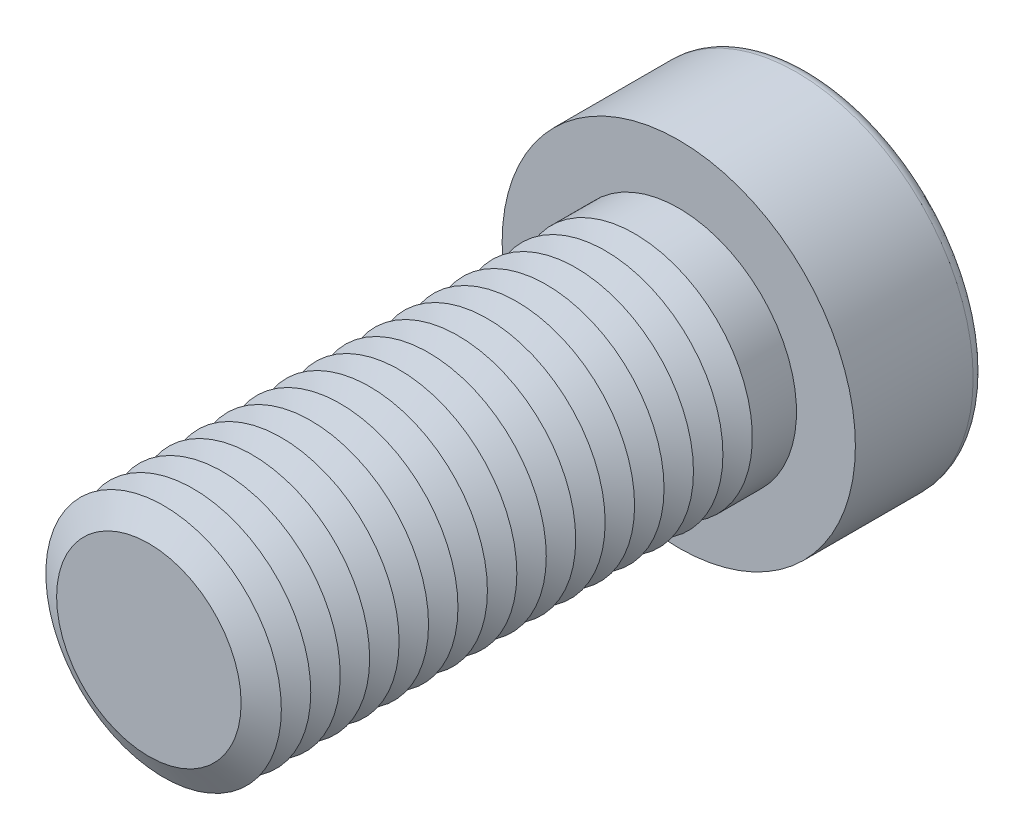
SolidWorks part; units mm, degrees
ref_plane "Front Plane" through (0, 0, 0) normal (0, 0, 1) x (1, 0, 0)
ref_plane "Top Plane" through (0, 0, 0) normal (0, 1, 0) x (1, 0, 0)
ref_plane "Right Plane" through (0, 0, 0) normal (1, 0, 0) x (0, 0, -1)
sketch "Sketch1" plane through (0, 0, 0) normal (0, 0, 1) x (1, 0, 0)
  circle A0 centre (0, 0) radius 10
  dimension "D1" = 20
extrude "Boss-Extrude1" add sketch "Sketch1" along normal blind 45
sketch "Sketch2" plane through (0, 0, 0) normal (0, 0, -1) x (-1, 0, 0)
  circle A0 centre (0, 0) radius 15
  dimension "D1" = 30
extrude "Boss-Extrude2" add sketch "Sketch2" along normal blind 11
sketch "Sketch3" plane through (0, 0, -11) normal (0, 0, -1) x (-1, 0, 0)
  line L1 (-4.0415, 7) -> (-8.0829, 0)
  line L2 (-8.0829, 0) -> (-4.0415, -7)
  line L3 (-4.0415, -7) -> (4.0415, -7)
  line L4 (4.0415, -7) -> (8.0829, 0)
  line L5 (8.0829, 0) -> (4.0415, 7)
  line L6 (4.0415, 7) -> (-4.0415, 7)
  circle A0 centre (0, 0) radius 7 construction
  dimension "D1" = 14
extrude "Cut-Extrude1" cut sketch "Sketch3" against normal blind 10.5
fillet "Fillet1" radius 1 1 edges at (-15, 0, -11)
sketch "Sketch4" plane through (0, 0, -0.5) normal (0, 0, -1) x (-1, 0, 0)
  line L0 (4.0415, -7) -> (8.0829, 0) construction
  circle A0 centre (0, 0) radius 7
extrude "Cut-Extrude2" cut sketch "Sketch4" against normal through all draft 60
sketch "Sketch5" plane through (0, 0, -11) normal (0, 0, -1) x (-1, 0, 0)
  circle A0 centre (0, 0) radius 8.0829
extrude "Cut-Extrude3" cut sketch "Sketch5" against normal through all draft 75
sketch "Sketch7" plane through (0, 0, 0) normal (1, 0, 0) x (0, 0, -1)
  line L25 (-45, 7.8349) -> (-43.75, 10)
  line L26 (-45, 10) -> (-45, -10) construction
  line L27 (-43.75, 10) -> (-46.25, 10)
  line L28 (-46.25, 10) -> (-45, 7.8349)
  line L29 (0, 10) -> (-45, 10) construction
  dimension "D1" = 2.5
revolve "Cut-Revolve1" cut sketch "Sketch7" angle 360 about axis through (0, 0, 45) along (0, 0, -1)
pattern_linear "LPattern1" count 17 spacing 2.5 along (0, 0, -1) of "Cut-Revolve1"
